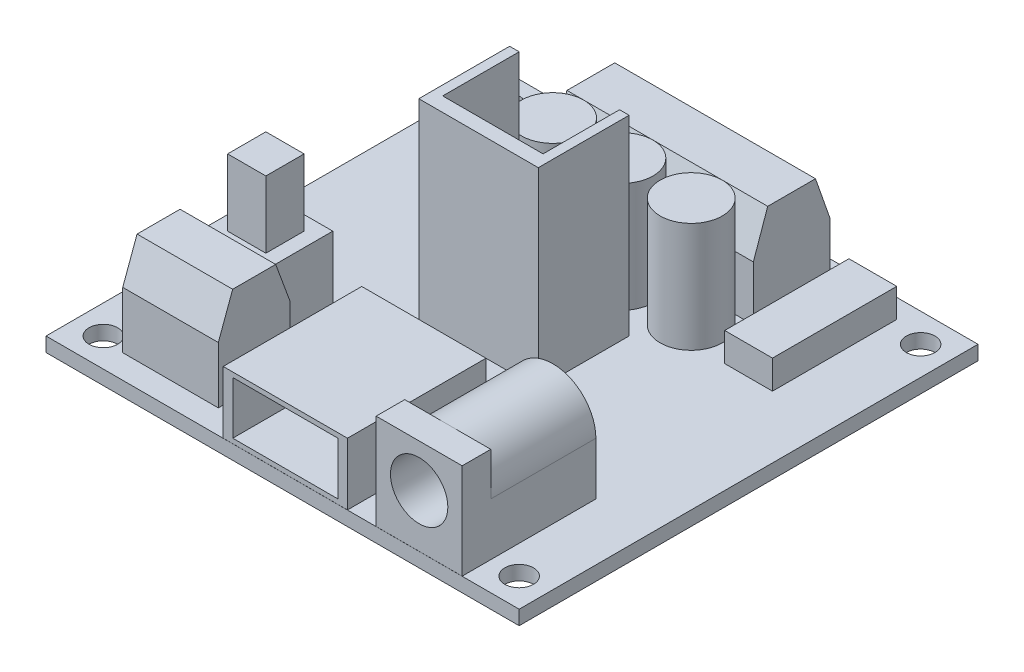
SolidWorks part; units mm, degrees
ref_plane "前视基准面" through (0, 0, 0) normal (0, 0, 1) x (1, 0, 0)
ref_plane "上视基准面" through (0, 0, 0) normal (0, 1, 0) x (1, 0, 0)
ref_plane "右视基准面" through (0, 0, 0) normal (1, 0, 0) x (0, 0, -1)
sketch "草图1" plane through (0, 0, 0) normal (0, 1, 0) x (1, 0, 0)
  line L0 (20.1655, 43.5544) -> (20.1655, -4.4456) construction
  line L1 (-4.5845, 43.5544) -> (44.9155, 43.5544)
  line L2 (-4.5845, 43.5544) -> (-4.5845, -4.4456)
  line L3 (-4.5845, -4.4456) -> (44.9155, -4.4456)
  line L4 (44.9155, 43.5544) -> (44.9155, -4.4456)
  line L5 (44.9155, 19.5544) -> (-4.5845, 19.5544) construction
  circle A0 centre (-1.5845, -1.4456) radius 1.5
  circle A1 centre (-1.5845, 40.5544) radius 1.5
  circle A2 centre (41.9155, -1.4456) radius 1.5
  circle A3 centre (41.9155, 40.5544) radius 1.5
  point P0 (0, 0)
  dimension "D1" = 3
  dimension "D2" = 49.5
  dimension "D4" = 3
  dimension "D3" = 48
extrude "凸台-拉伸1" add sketch "草图1" along normal blind 1.5
sketch "草图2" plane through (0, 1.5, 0) normal (0, 1, 0) x (1, 0, 0)
  line L0 (44.9155, 43.5544) -> (-4.5845, 43.5544) construction
  line L1 (10.4155, 41.5544) -> (31.4155, 41.5544)
  line L2 (10.4155, 41.5544) -> (10.4155, 33.5544)
  line L3 (10.4155, 33.5544) -> (31.4155, 33.5544)
  line L4 (31.4155, 41.5544) -> (31.4155, 33.5544)
  line L5 (10.4155, 41.5544) -> (31.4155, 33.5544) construction
  line L6 (10.4155, 33.5544) -> (31.4155, 41.5544) construction
  line L7 (44.9155, -4.4456) -> (44.9155, 43.5544) construction
  point P0 (20.9155, 37.5544)
  dimension "D1" = 8
  dimension "D2" = 21
  dimension "D3" = 2
  dimension "D4" = 13.5
extrude "凸台-拉伸2" add sketch "草图2" along normal blind 10
sketch "草图3" plane through (31.4155, 0, 0) normal (1, 0, 0) x (0, 0, -1)
  line L0 (37.5544, 11.5) -> (37.5544, 1.5) construction
  line L1 (33.5544, 11.5) -> (41.5544, 11.5) construction
  line L2 (33.5544, 1.5) -> (41.5544, 1.5) construction
  line L3 (33.5544, 7.2105) -> (30.163, 7.6759)
  line L4 (35.0544, 11.5) -> (33.5544, 7.2105)
  line L6 (33.5544, 11.5) -> (33.5544, 1.5) construction
  line L7 (40.0544, 11.5) -> (41.5544, 7.2105)
  line L8 (30.163, 7.6759) -> (31.0647, 12.6787)
  line L9 (31.0647, 12.6787) -> (44.7351, 12.0097)
  line L10 (44.7351, 12.0097) -> (43.4262, 7.2105)
  line L11 (43.4262, 7.2105) -> (41.5544, 7.2105)
  line L12 (35.0544, 11.5) -> (40.0544, 11.5)
extrude "切除-拉伸2" cut sketch "草图3" against normal blind 23
sketch "草图4" plane through (0, 1.5, 0) normal (0, 1, 0) x (1, 0, 0)
  line L0 (44.9155, 43.5544) -> (-4.5845, 43.5544) construction
  line L1 (33.4155, 41.5544) -> (38.4155, 41.5544)
  line L2 (33.4155, 41.5544) -> (33.4155, 28.5544)
  line L3 (33.4155, 28.5544) -> (38.4155, 28.5544)
  line L4 (38.4155, 41.5544) -> (38.4155, 28.5544)
  line L5 (33.4155, 41.5544) -> (38.4155, 28.5544) construction
  line L6 (33.4155, 28.5544) -> (38.4155, 41.5544) construction
  line L7 (31.4155, 33.5544) -> (31.4155, 41.5544) construction
  line L8 (20.9155, 41.5544) -> (20.9155, 32.6133) construction
  line L9 (31.4155, 41.5544) -> (10.4155, 41.5544) construction
  line L10 (8.4155, 28.5544) -> (3.4155, 41.5544) construction
  line L11 (8.4155, 41.5544) -> (3.4155, 28.5544) construction
  line L12 (3.4155, 41.5544) -> (3.4155, 28.5544)
  line L13 (8.4155, 28.5544) -> (3.4155, 28.5544)
  line L14 (8.4155, 41.5544) -> (8.4155, 28.5544)
  line L15 (8.4155, 41.5544) -> (3.4155, 41.5544)
  point P0 (35.9155, 35.0544)
  point P17 (5.9155, 35.0544)
  dimension "D1" = 5
  dimension "D2" = 13
  dimension "D3" = 2
  dimension "D4" = 2
extrude "凸台-拉伸3" add sketch "草图4" along normal blind 3
sketch "草图5" plane through (0, 1.5, 0) normal (0, 1, 0) x (1, 0, 0)
  line L0 (10.4155, 41.5544) -> (10.4155, 33.5544) construction
  line L1 (10.4155, 33.5544) -> (31.4155, 33.5544) construction
  line L2 (10.4155, 30.3044) -> (33.4155, 30.3044) construction
  line L3 (33.4155, 41.5544) -> (33.4155, 28.5544) construction
  line L4 (31.4155, 33.5544) -> (31.4155, 21.4066) construction
  circle A0 centre (13.6655, 30.3044) radius 3.25
  circle A1 centre (20.9155, 30.3044) radius 3.25
  circle A2 centre (28.1655, 30.3044) radius 3.25
  dimension "D1" = 3.25
  dimension "D3" = 3.25
  dimension "D4" = 3.25
  dimension "D2" = 3
extrude "凸台-拉伸5" add sketch "草图5" along normal blind 11.5 separate body
sketch "草图6" plane through (0, 1.5, 0) normal (0, 1, 0) x (1, 0, 0)
  line L0 (31.4155, 41.5544) -> (10.4155, 41.5544) construction
  line L1 (13.4155, 26.0544) -> (14.4155, 26.0544)
  line L2 (13.4155, 26.0544) -> (13.4155, 16.5544)
  line L3 (13.4155, 16.5544) -> (25.9155, 16.5544)
  line L4 (25.9155, 26.0544) -> (25.9155, 16.5544)
  line L5 (14.4155, 26.0544) -> (14.4155, 18.0544)
  line L6 (14.4155, 18.0544) -> (24.9155, 18.0544)
  line L7 (44.9155, -4.4456) -> (44.9155, 43.5544) construction
  line L8 (44.9155, -4.4456) -> (44.9155, 43.5544) construction
  line L9 (24.9155, 18.0544) -> (24.9155, 26.0544)
  line L10 (24.9155, 26.0544) -> (25.9155, 26.0544)
  point P0 (19.6655, 21.3044)
  dimension "D1" = 9.5
  dimension "D2" = 12.5
  dimension "D3" = 25
  dimension "D4" = 19
extrude "凸台-拉伸6" add sketch "草图6" along normal blind 20
sketch "草图7" plane through (0, 1.5, 0) normal (0, 1, 0) x (1, 0, 0)
  line L0 (-4.5845, 43.5544) -> (-4.5845, -4.4456) construction
  line L1 (0.9155, 13.0544) -> (7.9155, 13.0544)
  line L2 (0.9155, 13.0544) -> (0.9155, 6.0544)
  line L3 (0.9155, 6.0544) -> (7.9155, 6.0544)
  line L4 (7.9155, 13.0544) -> (7.9155, 6.0544)
  line L5 (0.9155, 13.0544) -> (7.9155, 6.0544) construction
  line L6 (0.9155, 6.0544) -> (7.9155, 13.0544) construction
  line L7 (-4.5845, -4.4456) -> (44.9155, -4.4456) construction
  point P0 (4.4155, 9.5544)
  dimension "D1" = 7
  dimension "D2" = 7
  dimension "D3" = 5.5
  dimension "D4" = 17.5
extrude "凸台-拉伸7" add sketch "草图7" along normal blind 7
sketch "草图8" plane through (0, 8.5, 0) normal (0, 1, 0) x (1, 0, 0)
  line L0 (0.9155, 13.0544) -> (7.9155, 6.0544) construction
  line L2 (2.4155, 11.5544) -> (6.4155, 11.5544)
  line L3 (2.4155, 11.5544) -> (2.4155, 7.5544)
  line L4 (2.4155, 7.5544) -> (6.4155, 7.5544)
  line L5 (6.4155, 11.5544) -> (6.4155, 7.5544)
  line L6 (2.4155, 11.5544) -> (6.4155, 7.5544) construction
  line L7 (2.4155, 7.5544) -> (6.4155, 11.5544) construction
  point P4 (4.4155, 9.5544)
extrude "凸台-拉伸8" add sketch "草图8" along normal blind 7
sketch "草图9" plane through (0, 1.5, 0) normal (0, 1, 0) x (1, 0, 0)
  line L0 (-4.5845, -4.4456) -> (44.9155, -4.4456) construction
  line L1 (0.9427, 5.5544) -> (10.9427, 5.5544)
  line L2 (0.9427, 5.5544) -> (0.9427, -1.9456)
  line L3 (0.9427, -1.9456) -> (10.9427, -1.9456)
  line L4 (10.9427, 5.5544) -> (10.9427, -1.9456)
  line L5 (0.9427, 5.5544) -> (10.9427, -1.9456) construction
  line L6 (0.9427, -1.9456) -> (10.9427, 5.5544) construction
  point P0 (5.9427, 1.8044)
  dimension "D1" = 7.5
  dimension "D2" = 10
  dimension "D3" = 2.5
extrude "凸台-拉伸10" add sketch "草图9" along normal blind 10
sketch "草图10" plane through (0, 1.5, 0) normal (0, 1, 0) x (1, 0, 0)
  line L0 (10.9427, -1.9456) -> (10.9427, 5.5544) construction
  line L1 (13.9427, 10.0578) -> (26.9427, 10.0578)
  line L2 (13.9427, 10.0578) -> (13.9427, -4.4456)
  line L3 (13.9427, -4.4456) -> (26.9427, -4.4456)
  line L4 (26.9427, 10.0578) -> (26.9427, -4.4456)
  line L5 (13.9427, 10.0578) -> (26.9427, -4.4456) construction
  line L6 (13.9427, -4.4456) -> (26.9427, 10.0578) construction
  point P0 (20.4427, 2.8061)
  point P5 (10.9427, 1.8044)
  dimension "D1" = 13
  dimension "D2" = 3
extrude "凸台-拉伸11" add sketch "草图10" along normal blind 6.5
sketch "草图12" plane through (0, 0, 4.4456) normal (0, 0, 1) x (1, 0, 0)
  line L0 (13.9427, 8) -> (26.9427, 1.5) construction
  line L1 (13.9427, 8) -> (26.9427, 8) construction
  line L2 (14.9427, 7.5) -> (25.9427, 7.5)
  line L3 (14.9427, 7.5) -> (14.9427, 2)
  line L4 (14.9427, 2) -> (25.9427, 2)
  line L5 (25.9427, 7.5) -> (25.9427, 2)
  line L6 (14.9427, 7.5) -> (25.9427, 2) construction
  line L7 (14.9427, 2) -> (25.9427, 7.5) construction
  point P4 (20.4427, 4.75)
  dimension "D1" = 0.5
extrude "切除-拉伸3" cut sketch "草图12" against normal blind 13.5
sketch "草图13" plane through (0, 1.5, 0) normal (0, 1, 0) x (1, 0, 0)
  line L0 (26.9427, -4.4456) -> (44.9155, -4.4456) construction
  line L1 (29.9427, 9.5544) -> (38.9427, 9.5544)
  line L2 (29.9427, 9.5544) -> (29.9427, -4.4456)
  line L3 (29.9427, -4.4456) -> (38.9427, -4.4456)
  line L4 (38.9427, 9.5544) -> (38.9427, -4.4456)
  line L5 (29.9427, 9.5544) -> (38.9427, -4.4456) construction
  line L6 (29.9427, -4.4456) -> (38.9427, 9.5544) construction
  line L7 (26.9427, -4.4456) -> (26.9427, 10.0578) construction
  point P0 (34.4427, 2.5544)
  dimension "D1" = 3
  dimension "D2" = 9
  dimension "D3" = 14
extrude "凸台-拉伸12" add sketch "草图13" along normal blind 10
sketch "草图14" plane through (0, 0, -9.5544) normal (0, 0, -1) x (-1, 0, 0)
  line L0 (-38.9427, 7) -> (-40.6493, 7)
  line L1 (-40.6493, 7) -> (-41.4834, 13.6497)
  line L2 (-41.4834, 13.6497) -> (-29.9427, 15.0973)
  line L3 (-29.9427, 15.0973) -> (-28.9856, 14.0155)
  line L4 (-28.9856, 14.0155) -> (-28.9856, 7)
  line L5 (-28.9856, 7) -> (-29.9427, 7)
  arc A0 (-29.9427, 7) -> (-38.9427, 7) centre (-34.4427, 7) ccw
extrude "切除-拉伸4" cut sketch "草图14" against normal blind 11
sketch "草图16" plane through (0, 0, 4.4456) normal (0, 0, 1) x (1, 0, 0)
  line L0 (29.9427, 11.5) -> (38.9427, 11.5) construction
  line L1 (38.9427, 11.5) -> (38.9427, 2.5) construction
  line L2 (38.9427, 11.5) -> (38.9427, 1.5) construction
  line L3 (38.9427, 2.5) -> (29.9427, 11.5) construction
  circle A0 centre (34.4427, 7) radius 3
extrude "切除-拉伸5" cut sketch "草图16" against normal blind 9
sketch "草图17" plane through (0, 0, 4.4456) normal (0, 0, 1) x (1, 0, 0)
  line L0 (13.9427, 1.5) -> (38.9427, 1.5)
  line L1 (38.9427, 1.5) -> (38.9427, 11.5)
  line L2 (38.9427, 11.5) -> (13.9427, 11.5)
  line L3 (13.9427, 11.5) -> (13.9427, 1.5)
extrude "切除-拉伸6" cut sketch "草图17" against normal blind 0.01
sketch "草图18" plane through (0.9427, 0, 0) normal (-1, 0, 0) x (0, 0, 1)
  line L0 (-1.8044, 11.5) -> (-1.8044, 1.5) construction
  line L1 (-5.5544, 11.5) -> (1.9456, 11.5) construction
  line L2 (-5.5544, 1.5) -> (1.9456, 1.5) construction
  line L4 (-4.0544, 11.5) -> (-5.5544, 7.4227)
  line L5 (-5.5544, 11.5) -> (-5.5544, 1.5) construction
  line L6 (0.4456, 11.5) -> (1.9456, 7.4227)
  line L7 (-5.5544, 7.4227) -> (-6.8969, 12.5457)
  line L8 (-6.8969, 12.5457) -> (-4.8044, 15.2653)
  line L9 (-4.8044, 15.2653) -> (3.3647, 13.5295)
  line L10 (3.3647, 13.5295) -> (4.3588, 9.7359)
  line L11 (4.3588, 9.7359) -> (1.9456, 7.4227)
  line L12 (-4.0544, 11.5) -> (0.4456, 11.5)
extrude "切除-拉伸7" cut sketch "草图18" against normal blind 10
